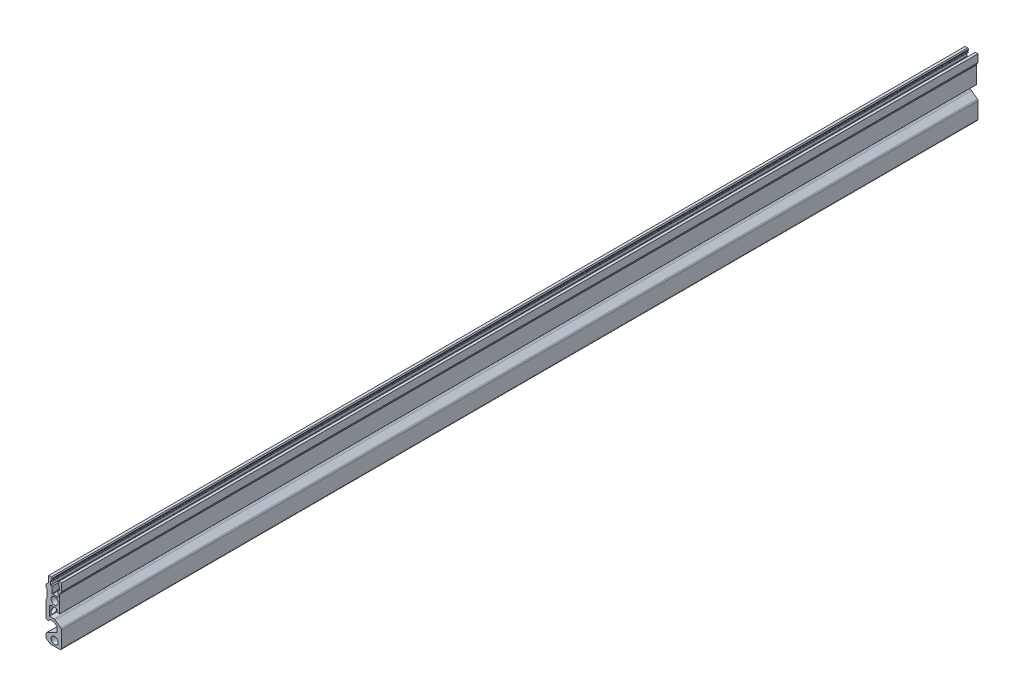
SolidWorks part; units mm, degrees
ref_plane "前视基准面" through (0, 0, 0) normal (0, 0, 1) x (1, 0, 0)
ref_plane "上视基准面" through (0, 0, 0) normal (0, 1, 0) x (1, 0, 0)
ref_plane "右视基准面" through (0, 0, 0) normal (1, 0, 0) x (0, 0, -1)
sketch "草图1" plane through (0, 0, 0) normal (0, 0, 1) x (1, 0, 0)
  line L0 (-2.3509, 8.9116) -> (-2.3509, 6.6116)
  line L1 (-2.3509, 8.9116) -> (-1.4509, 8.9116)
  line L2 (-1.4509, 8.9116) -> (-1.4509, 11.7916)
  line L3 (-1.4509, 11.7916) -> (-4.1259, 11.7916)
  line L4 (-4.1259, 11.7916) -> (-4.1259, 10.0616)
  line L5 (-4.1259, 10.0616) -> (-3.5009, 9.8916)
  line L6 (-3.5009, 9.8916) -> (-3.5009, 8.5216)
  line L7 (-3.5009, 8.5216) -> (-5.0009, 8.5216)
  line L8 (-5.0009, 8.5216) -> (-5.0009, 4.4416)
  line L9 (-5.0009, 4.4416) -> (-4.5507, 3.9414)
  line L10 (-4.5507, 3.9414) -> (-4.551, -1.0586)
  line L11 (-4.551, -1.0586) -> (-5.0009, -1.5584)
  line L12 (-5.0009, -1.5584) -> (-5.0009, -10.75)
  line L13 (-3.0009, -9.25) -> (-3.0009, -5.75)
  line L14 (2.9991, -5.05) -> (2.9991, -2.0584)
  line L15 (3.2991, -1.7584) -> (3.6991, -1.7584)
  line L16 (3.9991, -2.0584) -> (3.9991, -3.4584)
  line L17 (4.2991, -3.7584) -> (4.6991, -3.7584)
  line L18 (4.9991, -3.4584) -> (4.9991, 2.6416)
  line L19 (4.6991, 2.9416) -> (4.2991, 2.9416)
  line L20 (3.9991, 2.6416) -> (3.9991, 1.2416)
  line L21 (3.6991, 0.9416) -> (3.2991, 0.9416)
  line L22 (2.9991, 1.2416) -> (2.9991, 4.8054)
  line L23 (2.9991, 4.8054) -> (3.9991, 6.5374)
  line L24 (3.9991, 6.5374) -> (3.9991, 9.5216)
  line L25 (3.9991, 9.5216) -> (3.1241, 9.5216)
  line L26 (3.1241, 10.7916) -> (3.1241, 11.7916)
  line L27 (3.1241, 11.7916) -> (1.9491, 11.7916)
  line L28 (1.9491, 11.7916) -> (1.9491, 8.9116)
  line L29 (1.9491, 8.9116) -> (2.8491, 8.9116)
  line L30 (2.8491, 6.6116) -> (2.8491, 8.9116)
  line L31 (2.8491, 6.6116) -> (1.9491, 6.6116)
  line L32 (1.9491, 6.6116) -> (1.9491, 2.6797)
  line L33 (-1.4509, 2.9454) -> (-1.4509, 6.6116)
  line L34 (-1.4509, 6.6116) -> (-2.3509, 6.6116)
  line L35 (0, 0) -> (0, -5) construction
  line L39 (-2.5009, -5.25) -> (2.7991, -5.25)
  line L40 (-1.4509, 10.3516) -> (1.9491, 10.3516) construction
  line L41 (-3.0009, -10.75) -> (-5.0009, -10.75) construction
  line L42 (0.2491, 10.3516) -> (0.2491, 6.8507) construction
  line L43 (1.4991, -10.75) -> (1.4991, -17.25)
  line L44 (2.9991, -10.05) -> (2.9991, -22.2)
  line L45 (-3.0009, -10.75) -> (1.4991, -10.75)
  line L46 (-3.0009, -9.25) -> (2.1991, -9.25)
  line L47 (-5.0009, -22.2) -> (-5.0009, -18.05)
  line L48 (2.1991, -23) -> (-4.2009, -23)
  line L49 (-4.2009, -17.25) -> (1.4991, -17.25)
  arc A1 (3.2991, -1.7584) -> (2.9991, -2.0584) centre (3.2991, -2.0584) ccw
  arc A2 (3.9991, -2.0584) -> (3.6991, -1.7584) centre (3.6991, -2.0584) ccw
  arc A3 (3.9991, -3.4584) -> (4.2991, -3.7584) centre (4.2991, -3.4584) ccw
  arc A4 (4.6991, -3.7584) -> (4.9991, -3.4584) centre (4.6991, -3.4584) ccw
  arc A5 (4.9991, 2.6416) -> (4.6991, 2.9416) centre (4.6991, 2.6416) ccw
  arc A6 (4.2991, 2.9416) -> (3.9991, 2.6416) centre (4.2991, 2.6416) ccw
  arc A7 (3.6991, 0.9416) -> (3.9991, 1.2416) centre (3.6991, 1.2416) ccw
  arc A8 (2.9991, 1.2416) -> (3.2991, 0.9416) centre (3.2991, 1.2416) ccw
  arc A9 (3.1241, 10.7916) -> (3.1241, 9.5216) centre (3.1841, 10.1566) ccw
  circle A10 centre (0, 0) radius 1.6
  arc A11 (1.6398, 2.5122) -> (-1.1727, 2.7613) centre (0, 0) ccw
  arc A12 (1.6398, 2.5122) -> (1.9491, 2.6797) centre (1.7491, 2.6797) ccw
  arc A13 (-1.4509, 2.9454) -> (-1.1727, 2.7613) centre (-1.2509, 2.9454) ccw
  arc A17 (-4.2009, -17.25) -> (-5.0009, -18.05) centre (-4.2009, -18.05) ccw
  arc A18 (2.1991, -23) -> (2.9991, -22.2) centre (2.1991, -22.2) ccw
  arc A19 (2.7991, -5.25) -> (2.9991, -5.05) centre (2.7991, -5.05) ccw
  arc A20 (-3.0009, -5.75) -> (-2.5009, -5.25) centre (-2.5009, -5.75) cw
  circle A21 centre (0, -20) radius 1.6
  arc A22 (-5.0009, -22.2) -> (-4.2009, -23) centre (-4.2009, -22.2) ccw
  arc A23 (2.9991, -10.05) -> (2.1991, -9.25) centre (2.1991, -10.05) ccw
  arc A28 (-5.0009, -10.75) -> (-3.0009, -10.75) centre (-4.0009, -10.75) ccw
  dimension "D3" = 1.5
  dimension "D6" = 3.2
  dimension "D7" = 20
  dimension "D17" = 0.8
  dimension "D18" = 0.8
  dimension "D19" = 0.8
  dimension "D20" = 0.8
  dimension "D5" = 5.2
  dimension "D8" = 1
  dimension "D10" = 34.7916
  dimension "D12" = 5.75
  dimension "D13" = 13.75
  dimension "D16" = 8
extrude "凸台-拉伸1" add sketch "草图1" along normal mid plane 533.4
sketch "草图2" plane through (0, 0, -266.7) normal (0, 0, -1) x (-1, 0, 0)
  circle A0 centre (0, 0) radius 2.1
  circle A1 centre (0, -20) radius 2.1
  dimension "D1" = 4.2
  dimension "D2" = 4.2
extrude "切除-拉伸1" cut sketch "草图2" against normal blind 10
sketch "草图3" plane through (0, 0, 266.7) normal (0, 0, 1) x (1, 0, 0)
  circle A0 centre (0, 0) radius 2.1
  circle A1 centre (0, -20) radius 2.1
  dimension "D1" = 4.2
  dimension "D2" = 4.2
extrude "切除-拉伸2" cut sketch "草图3" against normal blind 10
sketch "草图4" plane through (-5.0009, 0, 0) normal (-1, 0, 0) x (0, 0, 1)
  line L0 (-266.7, -1.5584) -> (-266.7, -10.75) construction
  line L2 (-266.7, -11.75) -> (266.7, -11.75) construction
  circle A0 centre (-264.16, -7.5) radius 1.65
  circle A1 centre (-259.08, -7.5) radius 1.65
  circle A2 centre (-254, -7.5) radius 1.65
  circle A3 centre (-248.92, -7.5) radius 1.65
  circle A4 centre (-243.84, -7.5) radius 1.65
  circle A5 centre (-238.76, -7.5) radius 1.65
  circle A6 centre (-233.68, -7.5) radius 1.65
  circle A7 centre (-228.6, -7.5) radius 1.65
  circle A8 centre (-223.52, -7.5) radius 1.65
  circle A9 centre (-218.44, -7.5) radius 1.65
  circle A10 centre (-213.36, -7.5) radius 1.65
  circle A11 centre (-208.28, -7.5) radius 1.65
  circle A12 centre (-203.2, -7.5) radius 1.65
  circle A13 centre (-198.12, -7.5) radius 1.65
  circle A14 centre (-193.04, -7.5) radius 1.65
  circle A15 centre (-187.96, -7.5) radius 1.65
  circle A16 centre (-182.88, -7.5) radius 1.65
  circle A17 centre (-177.8, -7.5) radius 1.65
  circle A18 centre (-172.72, -7.5) radius 1.65
  circle A19 centre (-167.64, -7.5) radius 1.65
  circle A20 centre (-162.56, -7.5) radius 1.65
  circle A21 centre (-157.48, -7.5) radius 1.65
  circle A22 centre (-152.4, -7.5) radius 1.65
  circle A23 centre (-147.32, -7.5) radius 1.65
  circle A24 centre (-142.24, -7.5) radius 1.65
  circle A25 centre (-137.16, -7.5) radius 1.65
  circle A26 centre (-132.08, -7.5) radius 1.65
  circle A27 centre (-127, -7.5) radius 1.65
  circle A28 centre (-121.92, -7.5) radius 1.65
  circle A29 centre (-116.84, -7.5) radius 1.65
  circle A30 centre (-111.76, -7.5) radius 1.65
  circle A31 centre (-106.68, -7.5) radius 1.65
  circle A32 centre (-101.6, -7.5) radius 1.65
  circle A33 centre (-96.52, -7.5) radius 1.65
  circle A34 centre (-91.44, -7.5) radius 1.65
  circle A35 centre (-86.36, -7.5) radius 1.65
  circle A36 centre (-81.28, -7.5) radius 1.65
  circle A37 centre (-76.2, -7.5) radius 1.65
  circle A38 centre (-71.12, -7.5) radius 1.65
  circle A39 centre (-66.04, -7.5) radius 1.65
  circle A40 centre (-60.96, -7.5) radius 1.65
  circle A41 centre (-55.88, -7.5) radius 1.65
  circle A42 centre (-50.8, -7.5) radius 1.65
  circle A43 centre (-45.72, -7.5) radius 1.65
  circle A44 centre (-40.64, -7.5) radius 1.65
  circle A45 centre (-35.56, -7.5) radius 1.65
  circle A46 centre (-30.48, -7.5) radius 1.65
  circle A47 centre (-25.4, -7.5) radius 1.65
  circle A48 centre (-20.32, -7.5) radius 1.65
  circle A49 centre (-15.24, -7.5) radius 1.65
  circle A50 centre (-10.16, -7.5) radius 1.65
  circle A51 centre (-5.08, -7.5) radius 1.65
  circle A52 centre (0, -7.5) radius 1.65
  circle A53 centre (5.08, -7.5) radius 1.65
  circle A54 centre (10.16, -7.5) radius 1.65
  circle A55 centre (15.24, -7.5) radius 1.65
  circle A56 centre (20.32, -7.5) radius 1.65
  circle A57 centre (25.4, -7.5) radius 1.65
  circle A58 centre (30.48, -7.5) radius 1.65
  circle A59 centre (35.56, -7.5) radius 1.65
  circle A60 centre (40.64, -7.5) radius 1.65
  circle A61 centre (45.72, -7.5) radius 1.65
  circle A62 centre (50.8, -7.5) radius 1.65
  circle A63 centre (55.88, -7.5) radius 1.65
  circle A64 centre (60.96, -7.5) radius 1.65
  circle A65 centre (66.04, -7.5) radius 1.65
  circle A66 centre (71.12, -7.5) radius 1.65
  circle A67 centre (76.2, -7.5) radius 1.65
  circle A68 centre (81.28, -7.5) radius 1.65
  circle A69 centre (86.36, -7.5) radius 1.65
  circle A70 centre (91.44, -7.5) radius 1.65
  circle A71 centre (96.52, -7.5) radius 1.65
  circle A72 centre (101.6, -7.5) radius 1.65
  circle A73 centre (106.68, -7.5) radius 1.65
  circle A74 centre (111.76, -7.5) radius 1.65
  circle A75 centre (116.84, -7.5) radius 1.65
  circle A76 centre (121.92, -7.5) radius 1.65
  circle A77 centre (127, -7.5) radius 1.65
  circle A78 centre (132.08, -7.5) radius 1.65
  circle A79 centre (137.16, -7.5) radius 1.65
  circle A80 centre (142.24, -7.5) radius 1.65
  circle A81 centre (147.32, -7.5) radius 1.65
  circle A82 centre (152.4, -7.5) radius 1.65
  circle A83 centre (157.48, -7.5) radius 1.65
  circle A84 centre (162.56, -7.5) radius 1.65
  circle A85 centre (203.2, -7.5) radius 1.65
  circle A86 centre (243.84, -7.5) radius 1.65
  circle A87 centre (167.64, -7.5) radius 1.65
  circle A88 centre (182.88, -7.5) radius 1.65
  circle A89 centre (187.96, -7.5) radius 1.65
  circle A90 centre (213.36, -7.5) radius 1.65
  circle A91 centre (177.8, -7.5) radius 1.65
  circle A92 centre (233.68, -7.5) radius 1.65
  circle A93 centre (198.12, -7.5) radius 1.65
  circle A94 centre (218.44, -7.5) radius 1.65
  circle A95 centre (223.52, -7.5) radius 1.65
  circle A96 centre (254, -7.5) radius 1.65
  circle A97 centre (193.04, -7.5) radius 1.65
  circle A98 centre (172.72, -7.5) radius 1.65
  circle A99 centre (208.28, -7.5) radius 1.65
  circle A100 centre (248.92, -7.5) radius 1.65
  circle A101 centre (259.08, -7.5) radius 1.65
  circle A102 centre (228.6, -7.5) radius 1.65
  circle A103 centre (238.76, -7.5) radius 1.65
  circle A106 centre (264.16, -7.5) radius 1.65
  dimension "D1" = 3.3
  dimension "D5" = 5.08
  dimension "D3" = 4.25
  dimension "D2" = 2.54
  dimension "D4" = 85
extrude "切除-拉伸3" cut sketch "草图4" against normal blind 12
sketch "草图5" plane through (0, 0, 266.7) normal (0, 0, 1) x (1, 0, 0)
  line L0 (1.9491, 8.9116) -> (2.8491, 8.9116) construction
  line L1 (1.9491, 8.9116) -> (3.9991, 8.9116)
  line L2 (1.9491, 8.9116) -> (1.9491, 11.7916)
  line L3 (1.9491, 11.7916) -> (3.9991, 11.7916)
  line L4 (3.9991, 8.9116) -> (3.9991, 11.7916)
  line L5 (3.1241, 11.7916) -> (1.9491, 11.7916) construction
  line L6 (3.9991, 6.5374) -> (3.9991, 9.5216) construction
  line L7 (-1.4509, 11.7916) -> (-4.1259, 11.7916) construction
  line L8 (-5.0009, 8.5216) -> (-2.7884, 8.5216)
  line L9 (-5.0009, 8.5216) -> (-5.0009, 11.7916)
  line L10 (-5.0009, 11.7916) -> (-2.7884, 11.7916)
  line L11 (-2.7884, 8.5216) -> (-2.7884, 11.7916)
extrude "凸台-拉伸2" add sketch "草图5" against normal up to surface (533.4 mm away)
sketch "草图6" plane through (0, 0, -266.7) normal (0, 0, -1) x (-1, 0, 0)
  line L0 (-1.9491, 9.4916) -> (1.4509, 9.4916) construction
  line L1 (-1.9491, 11.7916) -> (-1.9491, 8.9116) construction
  line L2 (1.4509, 8.9116) -> (1.4509, 11.7916) construction
  line L3 (1.4509, 11.7916) -> (5.0009, 11.7916) construction
  line L4 (-2.3491, 8.9916) -> (1.8509, 8.9916)
  line L5 (-2.3491, 8.9916) -> (-2.3491, 9.9916)
  line L6 (-2.3491, 9.9916) -> (1.8509, 9.9916)
  line L7 (1.8509, 8.9916) -> (1.8509, 9.9916)
  line L8 (-2.3491, 8.9916) -> (1.8509, 9.9916) construction
  line L9 (-2.3491, 9.9916) -> (1.8509, 8.9916) construction
  point P6 (-0.2491, 9.4916)
  dimension "D1" = 1
  dimension "D2" = 4.2
  dimension "D3" = 1.8
extrude "切除-拉伸4" cut sketch "草图6" against normal through all
sketch "草图8" plane through (0, 0, -266.7) normal (0, 0, -1) x (-1, 0, 0)
  line L0 (5.0009, 11.7916) -> (5.0009, 4.4416) construction
  line L1 (-3.9991, 11.7916) -> (5.0009, 11.7916)
  line L2 (-3.9991, 11.7916) -> (-3.9991, 11.0016)
  line L3 (-3.9991, 11.0016) -> (5.0009, 11.0016)
  line L4 (5.0009, 11.7916) -> (5.0009, 11.0016)
  dimension "D1" = 0.79
extrude "切除-拉伸6" cut sketch "草图8" against normal through all
fillet "圆角1" radius 0.5 4 edges at (-1.8509, 9.9916, 0) (-1.8509, 8.9916, 0) (2.3491, 9.9916, 0) (2.3491, 8.9916, 0)
chamfer "倒角1" distance 0.5 angle 45 2 edges at (-1.4509, 11.0016, 0) (1.9491, 11.0016, 0)
fillet "圆角2" radius 0.2 6 edges at (1.9491, 10.5016, 0) (-1.4509, 10.5016, 0) (-1.4509, 8.9916, 0) (-1.4509, 9.9916, 0) (1.9491, 8.9916, 0) (1.9491, 9.9916, 0)
fillet "圆角3" radius 0.1 2 edges at (-1.4509, 8.9116, 0) (1.9491, 8.9116, 0)
sketch "草图7" plane through (0, 0, -266.7) normal (0, 0, -1) x (-1, 0, 0)
  line L0 (5.0009, 11.0016) -> (3.5009, 11.0016)
  line L2 (3.5009, 11.0016) -> (3.5009, 7.4416)
  line L3 (3.5009, 7.4416) -> (5.0009, 5.9416)
  line L4 (5.0009, 11.0016) -> (5.0009, 4.4416) construction
  line L5 (5.0009, 5.9416) -> (5.0009, 11.0016)
  line L6 (1.4509, 10.1341) -> (1.4509, 10.4187) construction
  line L7 (1.9509, 11.0016) -> (5.0009, 11.0016) construction
  dimension "D1" = 2.05
  dimension "D2" = 1.5
  dimension "D3" = 45
extrude "切除-拉伸5" cut sketch "草图7" against normal through all
sketch "草图10" plane through (0, 0, -266.7) normal (0, 0, -1) x (-1, 0, 0)
  line L0 (5.0009, -19.75) -> (1.0009, -23)
  line L3 (5.0009, -18.05) -> (5.0009, -22.2) construction
  line L4 (4.2009, -23) -> (-2.1991, -23) construction
  line L5 (1.0009, -23) -> (6.263, -23)
  line L6 (6.263, -23) -> (6.263, -19.75)
  line L7 (6.263, -19.75) -> (5.0009, -19.75)
  line L8 (-1.4991, -17.25) -> (4.2009, -17.25) construction
  dimension "D1" = 2.5
  dimension "D2" = 4
extrude "切除-拉伸7" [suppressed] cut sketch "草图10" against normal through all
fillet "圆角4" [suppressed] radius 0.8
sketch "草图11" plane through (0, 0, -266.7) normal (0, 0, -1) x (-1, 0, 0)
  line L2 (5.0009, -18.05) -> (5.0009, -22.2) construction
  line L7 (5.0009, -21.375) -> (5.0009, -23)
  line L8 (5.0009, -23) -> (2.5009, -23)
  line L9 (4.2009, -23) -> (-2.1991, -23) construction
  line L10 (2.5009, -23) -> (5.0009, -21.375)
  line L11 (5.0009, -20.125) -> (-2.9991, -20.125) construction
  line L12 (-2.9991, -22.2) -> (-2.9991, -10.05) construction
  line L13 (3.0009, -6.25) -> (3.0009, -3.25)
  line L14 (3.0009, -9.25) -> (3.0009, -5.75) construction
  line L15 (3.0009, -3.25) -> (-1.4991, -3.25)
  line L16 (-1.4991, -3.25) -> (-1.4991, -6.25)
  line L17 (3.0009, -6.25) -> (-1.4991, -6.25)
  line L18 (2.5009, -5.25) -> (-2.7991, -5.25) construction
  line L20 (-2.9991, -5.05) -> (-2.9991, -2.0584) construction
  dimension "D1" = 1.625
  dimension "D4" = 5.5
  dimension "D5" = 2
  dimension "D6" = 3
  dimension "D7" = 1.5
extrude "切除-拉伸8" cut sketch "草图11" against normal through all
sketch "草图12" plane through (0, 0, -266.7) normal (0, 0, -1) x (-1, 0, 0)
  line L0 (2.5009, -17.25) -> (-1.4991, -17.25)
  line L1 (-1.4991, -17.25) -> (-1.4991, -15.25)
  line L2 (-1.4991, -15.25) -> (2.5009, -17.25)
  line L3 (0.5009, -10.75) -> (-1.4991, -12.25)
  line L4 (3.0009, -10.75) -> (-1.4991, -10.75) construction
  line L5 (-1.4991, -10.75) -> (-1.4991, -17.25) construction
  line L6 (-1.4991, -12.25) -> (-1.4991, -10.75)
  line L7 (-1.4991, -10.75) -> (0.5009, -10.75)
  dimension "D1" = 2
  dimension "D2" = 1.5
  dimension "D3" = 2
extrude "凸台-拉伸3" add sketch "草图12" against normal through all
sketch "草图14" plane through (0, 0, -266.7) normal (0, 0, -1) x (-1, 0, 0)
  line L0 (0.0009, -9.25) -> (-2.9991, -11.5)
  line L1 (-2.1991, -9.25) -> (3.0009, -9.25) construction
  line L2 (-2.9991, -22.2) -> (-2.9991, -10.05) construction
  line L3 (-2.9991, -11.5) -> (-2.9991, -9.25)
  line L4 (-2.9991, -9.25) -> (0.0009, -9.25)
  line L5 (-1.4991, -12.25) -> (0.5009, -10.75) construction
  line L6 (2.5009, -17.25) -> (5.961, -18.98)
  line L7 (5.961, -18.98) -> (5.961, -16.25)
  line L8 (5.961, -16.25) -> (2.5009, -17.25)
  dimension "D1" = 1.5
extrude "切除-拉伸10" cut sketch "草图14" against normal through all
fillet "圆角6" radius 1 10 edges at (-5.0009, -21.375, 0) (-5.0009, -18.5, 0) (1.4991, -15.25, 0) (-2.5009, -23, 0) (-0.5009, -10.75, 0) (2.9991, -11.5, 0) (-0.0009, -9.25, 0) (-3.0009, -3.25, 0) (1.4991, -3.25, 0) (1.4991, -5.25, 0)
sketch "草图15" plane through (0, 0, -266.7) normal (0, 0, -1) x (-1, 0, 0)
  line L0 (-2.1991, -23) -> (-2.9991, -23)
  line L1 (-2.9991, -23) -> (-2.9991, -22.2)
  line L2 (-2.9991, -22.2) -> (-2.1991, -23)
  line L3 (2.2044, -23) -> (-2.1991, -23) construction
  line L4 (-2.9991, -12) -> (-2.5991, -11.2)
  line L5 (-2.5991, -11.2) -> (-2.9991, -11.5)
  line L6 (-2.9991, -12) -> (-2.9991, -11.5)
extrude "凸台-拉伸4" add sketch "草图15" against normal through all
sketch "草图16" plane through (0, 0, -266.7) normal (0, 0, -1) x (-1, 0, 0)
  line L0 (-2.9991, -11.5) -> (-3.9991, -12.25)
  line L1 (-2.9991, -23) -> (-3.9991, -23)
  line L2 (-2.9991, -23) -> (-2.9991, -11.5)
  line L3 (-2.9991, -11.5) -> (-0.2658, -9.45) construction
  line L4 (-3.9991, -23) -> (-3.9991, -12.25)
  dimension "D1" = 1
extrude "凸台-拉伸5" add sketch "草图16" against normal through all
fillet "圆角7" radius 1 2 edges at (3.9991, -12.25, 0) (3.9991, -23, 0)
sketch "草图17" plane through (0, 0, -266.7) normal (0, 0, -1) x (-1, 0, 0)
  line L0 (-2.9991, -5.05) -> (-2.9991, -2.0584) construction
  line L1 (-2.9991, -6.1776) -> (-6.0043, -6.1776)
  line L2 (-2.9991, -6.1776) -> (-2.9991, 3.4413)
  line L3 (-2.9991, 3.4413) -> (-6.0043, 3.4413)
  line L4 (-6.0043, -6.1776) -> (-6.0043, 3.4413)
  line L5 (-2.9991, 1.2416) -> (-2.9991, 4.8054) construction
extrude "切除-拉伸11" cut sketch "草图17" against normal through all
